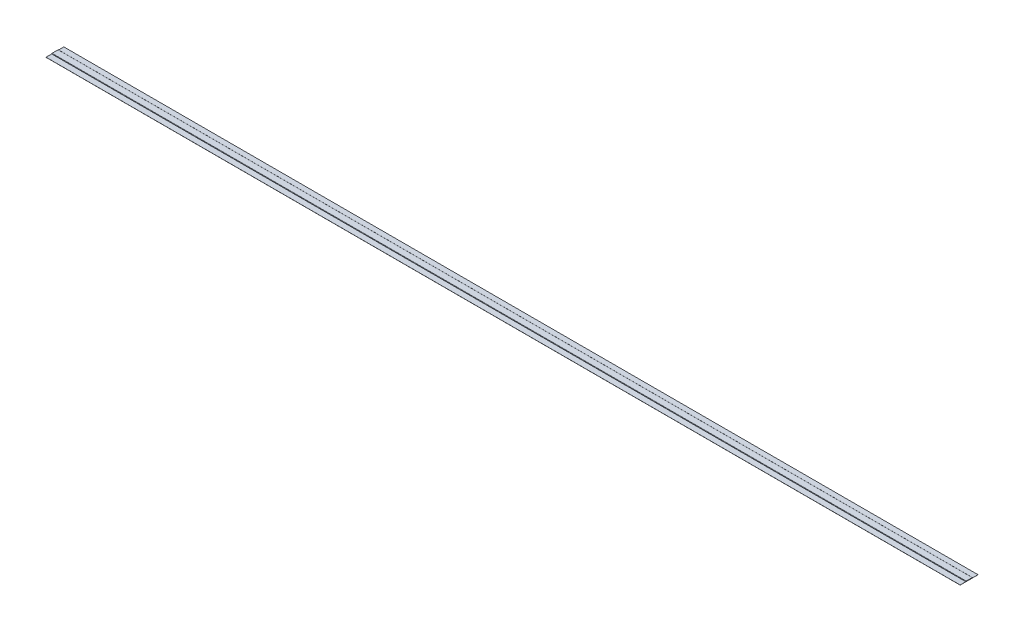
SolidWorks part; units mm, degrees
ref_plane "Front Plane" through (0, 0, 0) normal (0, 0, 1) x (1, 0, 0)
ref_plane "Top Plane" through (0, 0, 0) normal (0, 1, 0) x (1, 0, 0)
ref_plane "Right Plane" through (0, 0, 0) normal (1, 0, 0) x (0, 0, -1)
sketch "Sketch1" plane through (0, 0, 0) normal (0, 1, 0) x (1, 0, 0)
  line L1 (-609.6, 23.8125) -> (1828.8, 23.8125)
  line L2 (-609.6, 23.8125) -> (-609.6, -23.8125)
  line L3 (-609.6, -23.8125) -> (1828.8, -23.8125)
  line L4 (1828.8, 23.8125) -> (1828.8, -23.8125)
  dimension "D1" = 47.625
  dimension "D2" = 23.8125
  dimension "D3" = 2438.4
  dimension "D4" = 609.6
extrude "Boss-Extrude1" add sketch "Sketch1" along normal blind 0.254
sketch "Sketch2" plane through (1828.8, 0, 0) normal (1, 0, 0) x (0, 0, -1)
  line L0 (-7.62, 0.254) -> (8.38, 0.254) construction
  line L1 (-23.8125, 0.254) -> (23.8125, 0.254) construction
  line L2 (-7.62, 1.27) -> (8.38, 1.27)
  line L3 (-7.62, -0.762) -> (8.38, -0.762)
  line L4 (-8.6254, 0.1073) -> (9.3854, 0.1073)
  arc A0 (-7.62, 1.27) -> (-7.62, -0.762) centre (-7.62, 0.254) ccw
  arc A1 (8.38, -0.762) -> (8.38, 1.27) centre (8.38, 0.254) ccw
  point P4 (0.38, 0.254)
  dimension "D1" = 1.016
  dimension "D2" = 16
  dimension "D3" = 7.62
  dimension "D4" = 0.2934
extrude "Boss-Extrude2" add sketch "Sketch2" against normal up to surface (2438.4 mm away) contours A1 L2 A0 M5
